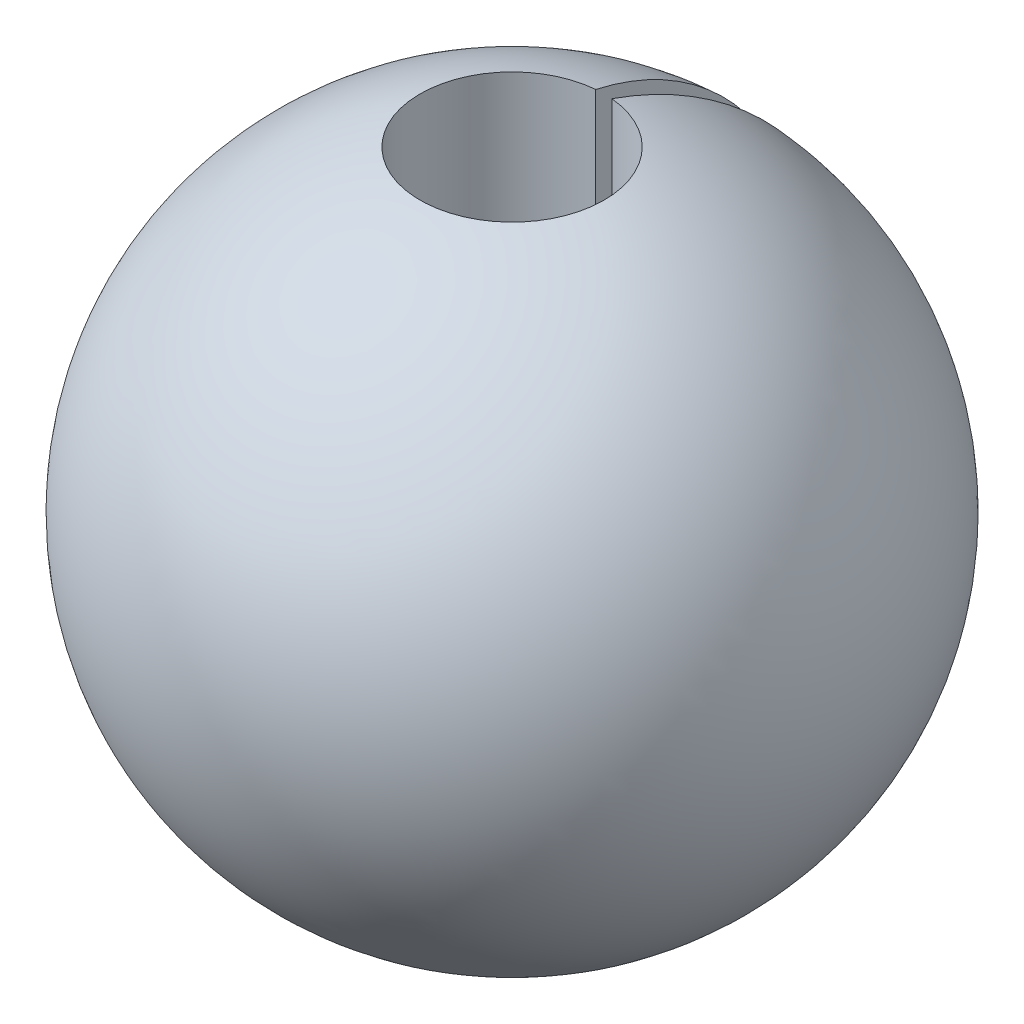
SolidWorks part; units mm, degrees
ref_plane "前视基准面" through (0, 0, 0) normal (0, 0, 1) x (1, 0, 0)
ref_plane "上视基准面" through (0, 0, 0) normal (0, 1, 0) x (1, 0, 0)
ref_plane "右视基准面" through (0, 0, 0) normal (1, 0, 0) x (0, 0, -1)
sketch "草图1" plane through (0, 0, 0) normal (1, 0, 0) x (0, 0, -1)
  line L0 (-285.6608, 180) -> (-125.8994, 180) construction
  line L2 (0, 241.2) -> (0, 0) construction
  line L3 (-301, -855.2819) -> (-301, 1211.8181)
  arc A0 (-301, 1211.8181) -> (-301, -855.2819) centre (-1.7503, 178.2681) ccw
  dimension "D2" = 2152
  dimension "D1" = 301
revolve "旋转1" add sketch "草图1" angle 350 mid plane about L2
